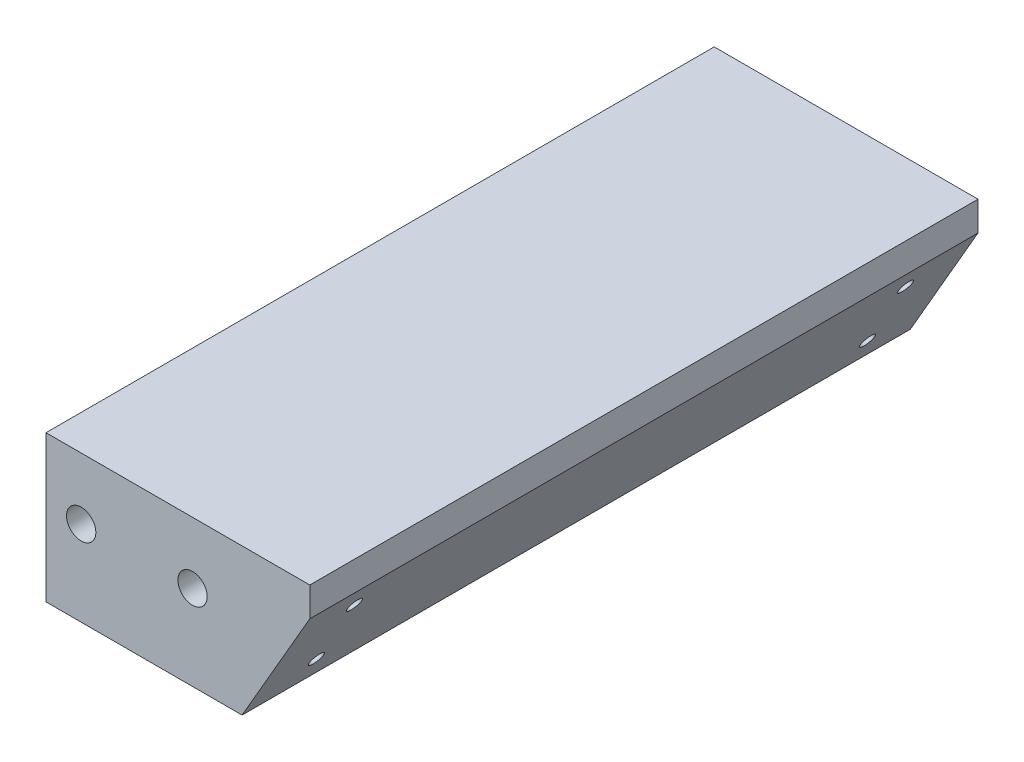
SolidWorks part; units mm, degrees
ref_plane "Front Plane" through (0, 0, 0) normal (0, 0, 1) x (1, 0, 0)
ref_plane "Top Plane" through (0, 0, 0) normal (0, 1, 0) x (1, 0, 0)
ref_plane "Right Plane" through (0, 0, 0) normal (1, 0, 0) x (0, 0, -1)
sketch "Sketch1" plane through (0, 0, 0) normal (0, 0, 1) x (1, 0, 0)
  line L0 (0, 0) -> (0, -25)
  line L1 (0, -25) -> (33.453, -25)
  line L2 (33.453, -25) -> (45, -5)
  line L3 (45, -5) -> (45, 0)
  line L4 (45, 0) -> (0, 0)
  dimension "D1" = 120
  dimension "D2" = 25
  dimension "D3" = 45
  dimension "D4" = 5
extrude "Boss-Extrude1" add sketch "Sketch1" along normal mid plane 114
hole_wizard "M6x1.0 Tapped Hole1" positions "Sketch3" profile "Sketch2" tap size "M6x1.0" standard "ANSI Metric"
sketch "Sketch3" plane through (0, 0, 57) normal (0, 0, 1) x (1, 0, 0)
  line L2 (0, 0) -> (0, -25) construction
  line L3 (45, 0) -> (0, 0) construction
  point P0 (25, -10.5)
  point P2 (6, -10.5)
  dimension "D1" = 6
  dimension "D2" = 25
  dimension "D3" = 10.5
  dimension "D4" = 10.5
sketch "Sketch2" plane through (25, -10.5, 57) normal (1, 0, 0) x (0, -1, 0)
  line L0 (0, 0) -> (0, 16.5022)
  line L1 (0, 16.5022) -> (2.5, 15)
  line L2 (2.5, 15) -> (2.5, 0)
  line L5 (2.5, 0) -> (0, 0)
  line L10 (0, 16.5022) -> (-2.5, 15) construction
  line L11 (0, -6.35) -> (0, 107.95) construction
  dimension "Tap Drill Dia." = 5
  dimension "Tap Drill Depth" = 15
  dimension "Drill Angle" = 118
mirror "Mirror1" about plane through (0, 0, 0) normal (0, 0, 1) of "M6x1.0 Tapped Hole1"
hole_wizard "M3x0.5 Tapped Hole1" positions "Sketch5" profile "Sketch4" tap size "M3x0.5" standard "ANSI Metric"
sketch "Sketch5" plane through (35.9151, -20.7356, 0) normal (0.866, -0.5, 0) x (0, 0, -1)
  point P0 (-47, 13.4075)
  point P3 (47, 13.4075)
  point P6 (47, 0.4289)
  point P9 (-47, 0.4289)
sketch "Sketch4" plane through (42.6188, -9.1244, 47) normal (0, 0, 1) x (0.5, 0.866, 0)
  line L0 (0, 0) -> (0, 12.7511)
  line L1 (0, 12.7511) -> (1.25, 12)
  line L2 (1.25, 12) -> (1.25, 0)
  line L5 (1.25, 0) -> (0, 0)
  line L10 (0, 12.7511) -> (-1.25, 12) construction
  line L11 (0, -6.35) -> (0, 107.95) construction
  dimension "Tap Drill Dia." = 2.5
  dimension "Tap Drill Depth" = 12
  dimension "Drill Angle" = 118
